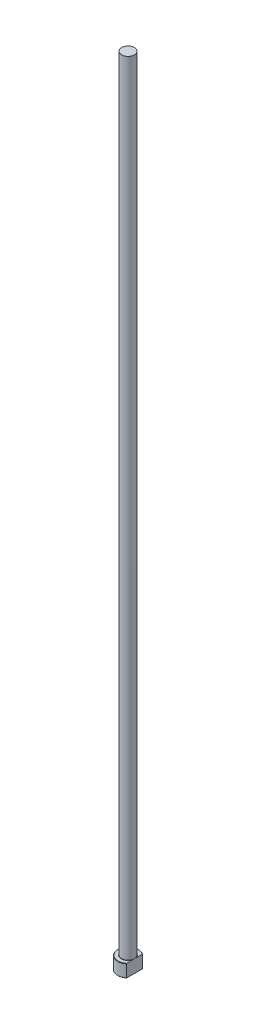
SolidWorks part; units mm, degrees
ref_plane "Front Plane" through (0, 0, 0) normal (0, 0, 1) x (1, 0, 0)
ref_plane "Top Plane" through (0, 0, 0) normal (0, 1, 0) x (1, 0, 0)
ref_plane "Right Plane" through (0, 0, 0) normal (1, 0, 0) x (0, 0, -1)
sketch "Sketch1" plane through (0, 0, 0) normal (0, 0, 1) x (1, 0, 0)
  line L0 (0, 259.9588) -> (0, -15.1925) construction
  line L1 (0, 0) -> (-6.5, 0)
  line L2 (-6.5, 0) -> (-6.5, 8)
  line L3 (-6.5, 8) -> (-4, 8)
  line L4 (-4, 8) -> (-4, 500)
  line L5 (-4, 500) -> (0, 500)
  line L6 (0, 500) -> (0, 0)
  dimension "L" = 500
  dimension "H" = 13
  dimension "T" = 8
  dimension "D" = 8
revolve "Revolve1" add sketch "Sketch1" angle 360 about L0
chamfer "Chamfer1" distance 0.2 angle 45 2 edges at (0, 8, 6.5) (0, 0, 6.5)
fillet "Fillet1" radius 0.2 1 edges at (0, 8, 4)
sketch "Sketch2" plane through (0, 0, 0) normal (0, 1, 0) x (1, 0, 0)
  line L0 (4, -5.1235) -> (4, 5.1235)
  circle A0 centre (0, 0) radius 6.5 construction
  arc A1 (4, -5.1235) -> (4, 5.1235) centre (0, 0) ccw
  circle A2 centre (0, 0) radius 4 construction
extrude "KEYED HEAD" cut sketch "Sketch2" along normal through all
